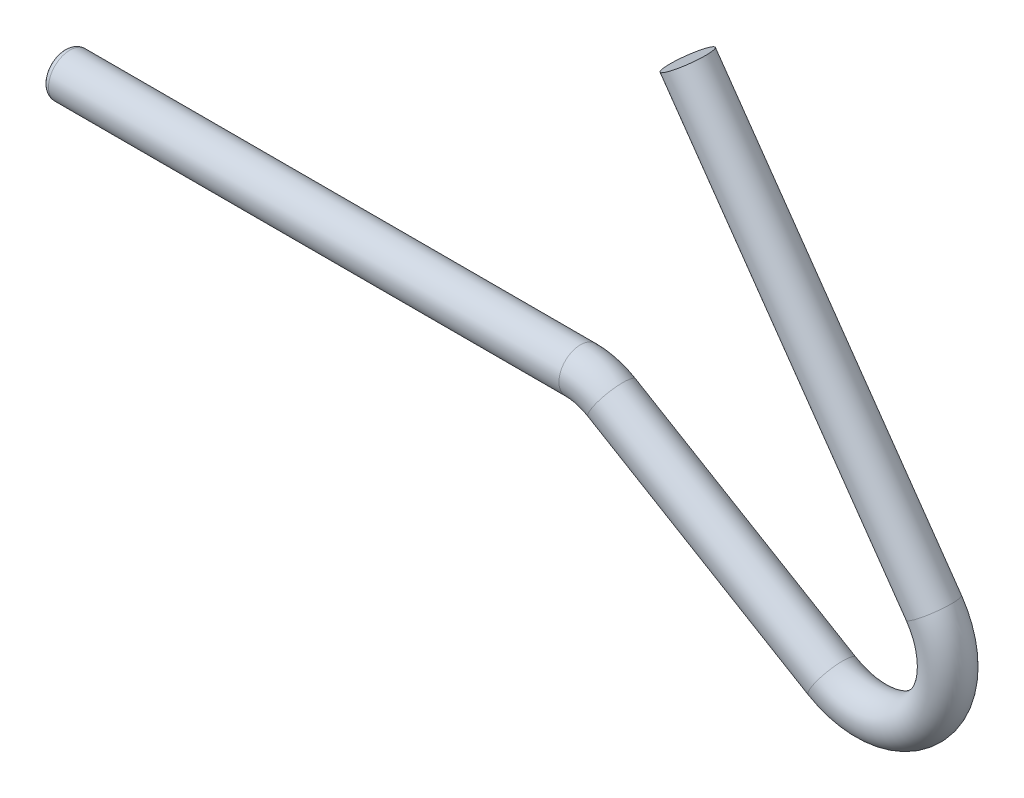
SolidWorks part; units mm, degrees
ref_plane "Plan de face" through (0, 0, 0) normal (0, 0, 1) x (1, 0, 0)
ref_plane "Plan de dessus" through (0, 0, 0) normal (0, 1, 0) x (1, 0, 0)
ref_plane "Plan de droite" through (0, 0, 0) normal (1, 0, 0) x (0, 0, -1)
sketch "Esquisse1" plane through (0, 0, 0) normal (0, 0, 1) x (1, 0, 0)
  line L0 (0, 0) -> (84.2524, 0)
  line L1 (89.3618, -1.4038) -> (125.267, -22.7452)
  line L2 (101.7428, 52.5103) -> (141.8931, -4.8303)
  arc A0 (125.267, -22.7452) -> (141.8931, -4.8303) centre (131.6537, -12) ccw
  arc A1 (89.3618, -1.4038) -> (84.2524, 0) centre (84.2524, -10) ccw
  circle A6 centre (131.6537, -12) radius 10 construction
  point P7 (87, 0)
  dimension "D6" = 25
  dimension "D7" = 10
  dimension "D1" = 87
  dimension "D2" = 70
  dimension "D5" = 55
sketch "Esquisse2" plane through (0, 0, 0) normal (1, 0, 0) x (0, 0, -1)
  circle A0 centre (0, 0) radius 3.5
  dimension "D1" = 7
sweep "Balayage1" add profiles "Esquisse2" path "Esquisse1"
fillet "Congé1" radius 1 1 edges at (0, 0, -3.5)
